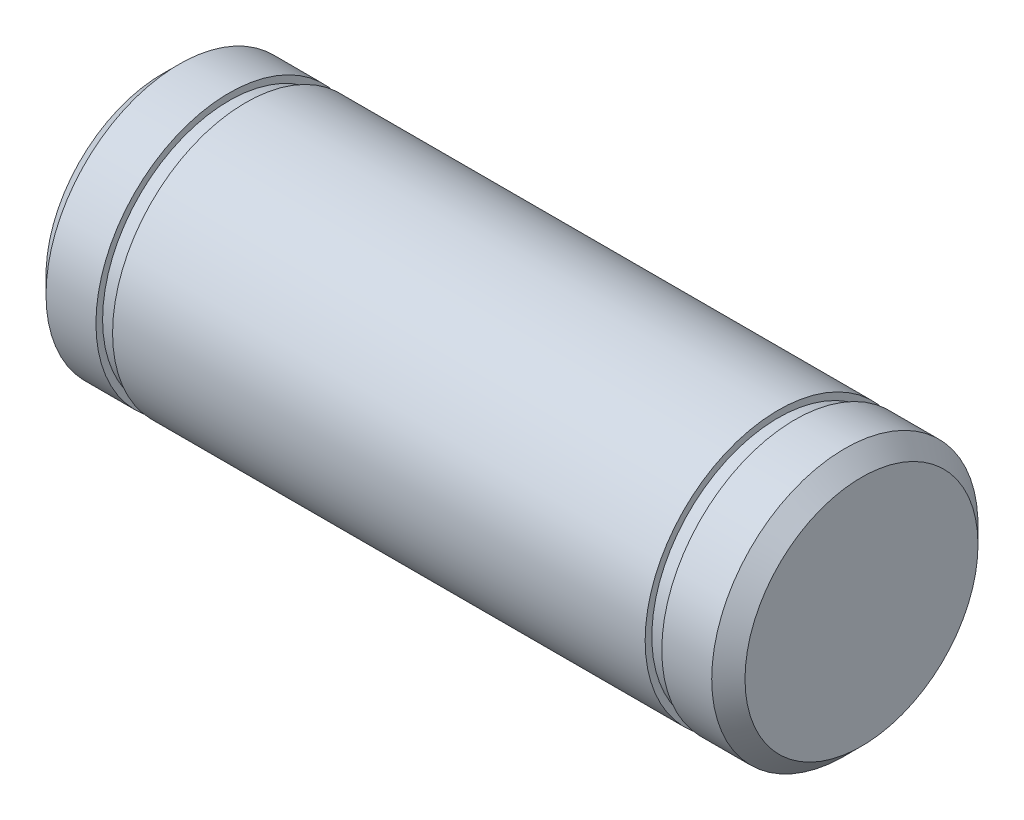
SolidWorks part; units mm, degrees
ref_plane "Front" through (0, 0, 0) normal (0, 0, 1) x (1, 0, 0)
ref_plane "Top" through (0, 0, 0) normal (0, 1, 0) x (1, 0, 0)
ref_plane "Right" through (0, 0, 0) normal (1, 0, 0) x (0, 0, -1)
sketch "Sketch1" plane through (0, 0, 0) normal (1, 0, 0) x (0, 0, -1)
  circle A0 centre (0, 0) radius 2
  dimension "D1" = 4
extrude "Boss-Extrude1" add sketch "Sketch1" along normal blind 10.5
sketch "Sketch2" plane through (10.5, 0, 0) normal (1, 0, 0) x (0, 0, -1)
  circle A0 centre (0, 0) radius 1.9
  circle A1 centre (0, 0) radius 2.4981
  dimension "D1" = 3.8
extrude "Cut-Extrude2" cut sketch "Sketch2" against normal blind 0.25 from offset 1
sketch "Sketch3" plane through (0, 0, 0) normal (-1, 0, 0) x (0, 0, 1)
  circle A0 centre (0, 0) radius 1.9
  circle A1 centre (0, 0) radius 2.5
extrude "Cut-Extrude3" cut sketch "Sketch3" against normal blind 0.25 from offset 1
chamfer "Chamfer1" distance 0.25 angle 45 2 edges at (0, 0, -2) (10.5, 0, -2)
